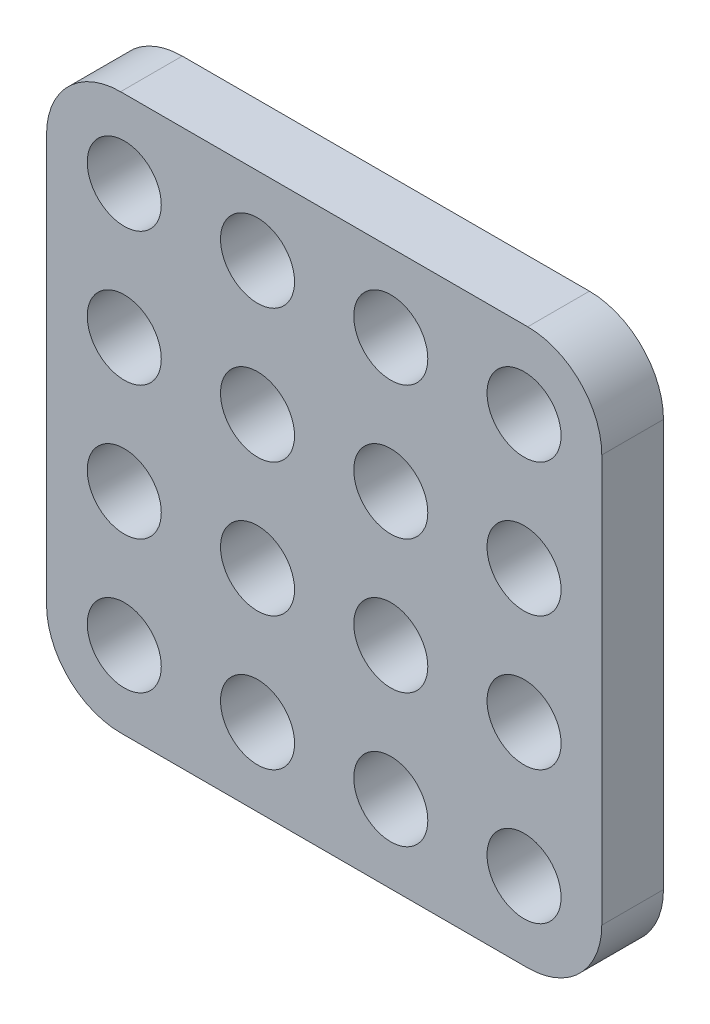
SolidWorks part; units mm, degrees
ref_plane "Plan de face" through (0, 0, 0) normal (0, 0, 1) x (1, 0, 0)
ref_plane "Plan de dessus" through (0, 0, 0) normal (0, 1, 0) x (1, 0, 0)
ref_plane "Plan de droite" through (0, 0, 0) normal (1, 0, 0) x (0, 0, -1)
sketch "Model" plane through (0, 0, 0) normal (0, 0, 1) x (1, 0, 0)
  line L0 (105.205, 230.5107) -> (105.205, 164.5107)
  line L1 (27.205, 152.5107) -> (93.205, 152.5107)
  line L2 (15.205, 230.5107) -> (15.205, 164.5107)
  line L3 (27.205, 242.5107) -> (93.205, 242.5107)
  circle A0 centre (71.005, 208.3107) radius 6
  circle A1 centre (92.605, 229.9107) radius 6
  circle A2 centre (92.605, 208.3107) radius 6
  circle A3 centre (71.005, 186.7107) radius 6
  circle A4 centre (27.805, 165.1107) radius 6
  circle A5 centre (92.605, 186.7107) radius 6
  arc A6 (105.205, 230.5107) -> (93.205, 242.5107) centre (93.205, 230.5107) ccw
  arc A7 (93.205, 152.5107) -> (105.205, 164.5107) centre (93.205, 164.5107) ccw
  arc A8 (15.205, 164.5107) -> (27.205, 152.5107) centre (27.205, 164.5107) ccw
  arc A9 (27.205, 242.5107) -> (15.205, 230.5107) centre (27.205, 230.5107) ccw
  circle A10 centre (27.805, 229.9107) radius 6
  circle A11 centre (27.805, 186.7107) radius 6
  circle A12 centre (71.005, 165.1107) radius 6
  circle A13 centre (92.605, 165.1107) radius 6
  circle A14 centre (49.405, 165.1107) radius 6
  circle A15 centre (27.805, 208.3107) radius 6
  circle A16 centre (49.405, 208.3107) radius 6
  circle A17 centre (49.405, 229.9107) radius 6
  circle A18 centre (49.405, 186.7107) radius 6
  circle A19 centre (71.005, 229.9107) radius 6
  dimension "D1" = 12
  dimension "D2" = 90
extrude "Boss.-Extru.1" add sketch "Model" along normal blind 10
